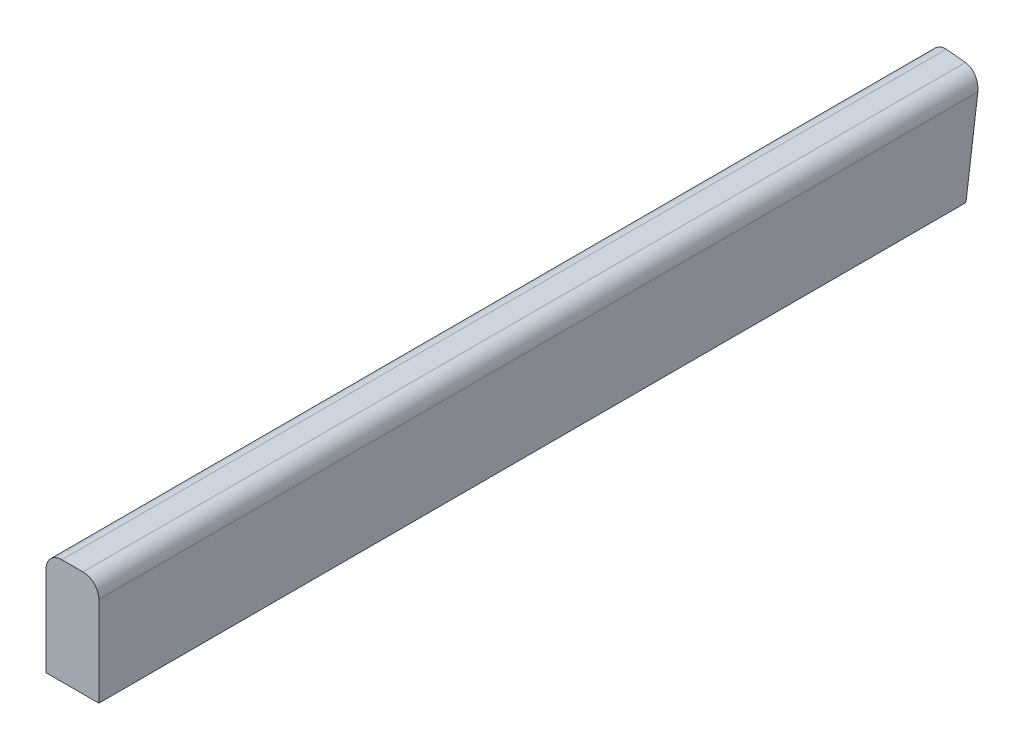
SolidWorks part; units mm, degrees
ref_plane "Ebene vorne" through (0, 0, 0) normal (0, 0, 1) x (1, 0, 0)
ref_plane "Ebene oben" through (0, 0, 0) normal (0, 1, 0) x (1, 0, 0)
ref_plane "Ebene rechts" through (0, 0, 0) normal (1, 0, 0) x (0, 0, -1)
sketch "Skizze1" plane through (0, 0, 0) normal (0, 0, 1) x (1, 0, 0)
  line L1 (0, 0) -> (10, 0)
  line L2 (0, 0) -> (0, 17)
  line L3 (3, 20) -> (7, 20)
  line L4 (10, 0) -> (10, 17)
  arc A0 (0, 17) -> (3, 20) centre (3, 17) cw
  arc A1 (10, 17) -> (7, 20) centre (7, 17) ccw
  point P7 (0, 20)
  dimension "D3" = 3
  dimension "D1" = 10
  dimension "D2" = 20
extrude "Linear austragen1" add sketch "Skizze1" against normal up to surface (164.8734 mm away)
